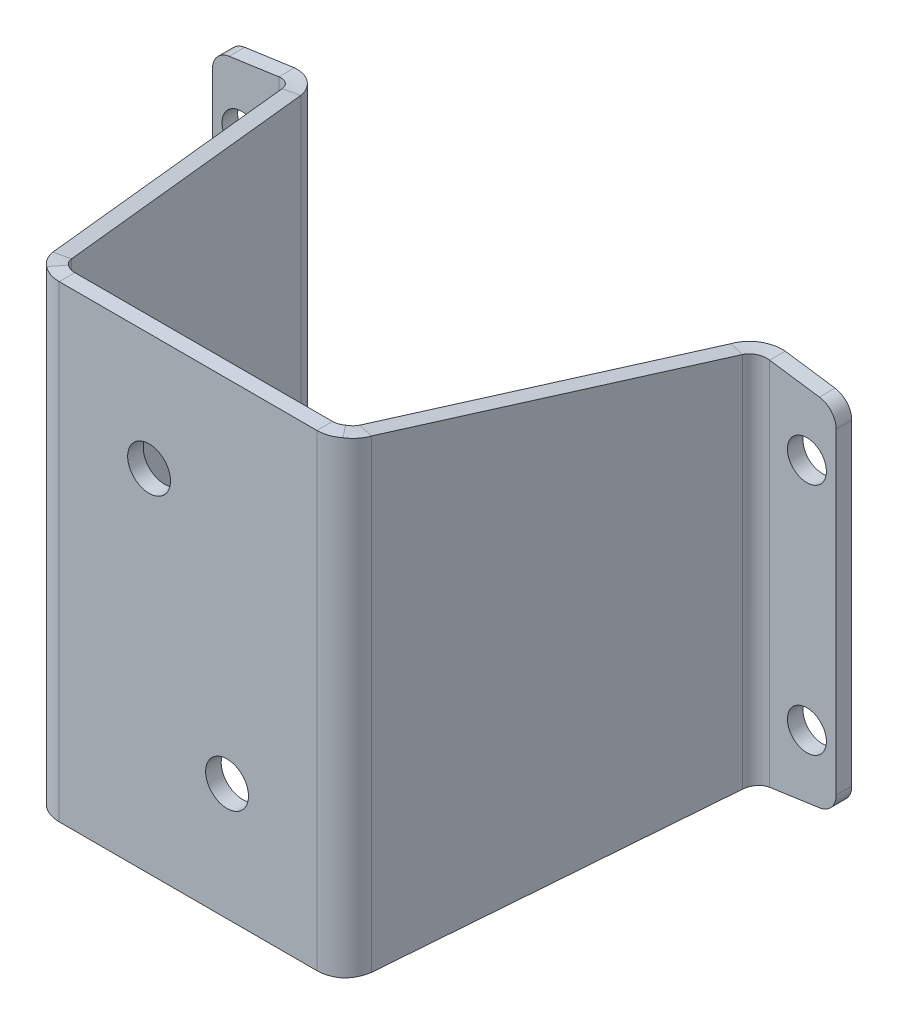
SolidWorks part; units mm, degrees
ref_plane "Plan1" through (0, 0, 0) normal (0, 0, 1) x (1, 0, 0)
ref_plane "Plan2" through (0, 0, 0) normal (0, 1, 0) x (1, 0, 0)
ref_plane "Plan3" through (0, 0, 0) normal (1, 0, 0) x (0, 0, -1)
sketch "Esquisse1" plane through (0, 0, 0) normal (0, 0, 1) x (1, 0, 0)
  line L0 (-136.7071, 45.6133) -> (-36, 60)
  line L1 (-36, 60) -> (36, 60)
  line L2 (36, 60) -> (136.7071, 45.6133)
  line L3 (141, 40.6635) -> (141, -40.6635)
  line L4 (136.7071, -45.6133) -> (36, -60)
  line L5 (36, -60) -> (-36, -60)
  line L6 (-36, -60) -> (-136.7071, -45.6133)
  line L7 (-141, -40.6635) -> (-141, 40.6635)
  circle A4 centre (-10, 30) radius 5.5
  circle A5 centre (10, -30) radius 5.5
  arc A6 (-141, 40.6635) -> (-136.7071, 45.6133) centre (-136, 40.6635) cw
  arc A7 (-136.7071, -45.6133) -> (-141, -40.6635) centre (-136, -40.6635) cw
  arc A8 (141, -40.6635) -> (136.7071, -45.6133) centre (136, -40.6635) cw
  arc A9 (141, 40.6635) -> (136.7071, 45.6133) centre (136, 40.6635) ccw
  point P23 (-141, 45)
  point P26 (-141, -45)
  point P31 (141, 45)
  dimension "D9" = 11
  dimension "D10" = 60
  dimension "D11" = 5
  dimension "D1" = 282
  dimension "D2" = 72
  dimension "D3" = 36
  dimension "D4" = 120
  dimension "D5" = 60
  dimension "D6" = 90
  dimension "D7" = 45
  dimension "D8" = 105
  dimension "D12" = 30
  dimension "D13" = 10
  dimension "D14" = 20
extrude "Base-Extrusion" add sketch "Esquisse1" along normal blind 4
sheet metal parameters "Tôlerie 1" parameters "D1"=4
flatten bends "Dépliage 1" parameters "D1"=0
sketch "Esquisse-Angle1" plane through (0, 0, 4) normal (0, 0, 1) x (1, 0, 0)
process bends "Pliage 1" parameters "D1"=0
sketch "Esquisse-Plate1" plane through (0, 0, 4) normal (0, 0, 1) x (1, 0, 0)
  line L0 (-36, 60) -> (-36, -60) construction
  line L1 (36, 60) -> (36, -60) construction
  line L2 (36, -60) -> (136.7071, -45.6133) construction
  line L3 (-121, 47.8571) -> (-121, -47.8571) construction
  line L4 (141, -40.6635) -> (141, 40.6635) construction
  line L5 (121, 47.8571) -> (121, -47.8571) construction
  line L6 (136.7071, 45.6133) -> (36, 60) construction
  line L7 (-36, 60) -> (-136.7071, 45.6133) construction
  line L8 (-136.7071, -45.6133) -> (-36, -60) construction
  line L9 (-141, 40.6635) -> (-141, -40.6635) construction
  point P9 (12, 0)
  dimension "D1" = 20
  dimension "D2" = 20
bend "Pli défini à plat1" bend radius 4 bend angle 76.7 parameters "D5"=1
bend "Pli défini à plat2" bend radius 4 bend angle 76.7 parameters "D5"=2
bend "Pli défini à plat3" bend radius 4 bend angle 76.7 parameters "D5"=3
bend "Pli défini à plat4" bend radius 4 bend angle 76.7 parameters "D5"=4
sketch "Esquisse6" plane through (0, 0, -86.2275) normal (0, 0, -1) x (-1, 0, 0)
  line L0 (-79.9872, -40.6635) -> (-79.9872, 40.6635) construction
  circle A0 centre (-72.4872, 30) radius 5
  circle A1 centre (-72.4872, -30) radius 5
  circle A2 centre (72.5128, -30) radius 5
  circle A3 centre (72.5128, 30) radius 5
  dimension "D1" = 10
  dimension "D2" = 60
  dimension "D3" = 30
  dimension "D4" = 145
  dimension "D5" = 7.5
extrude "Enlèv. mat.-Extru.1" cut sketch "Esquisse6" against normal through all
